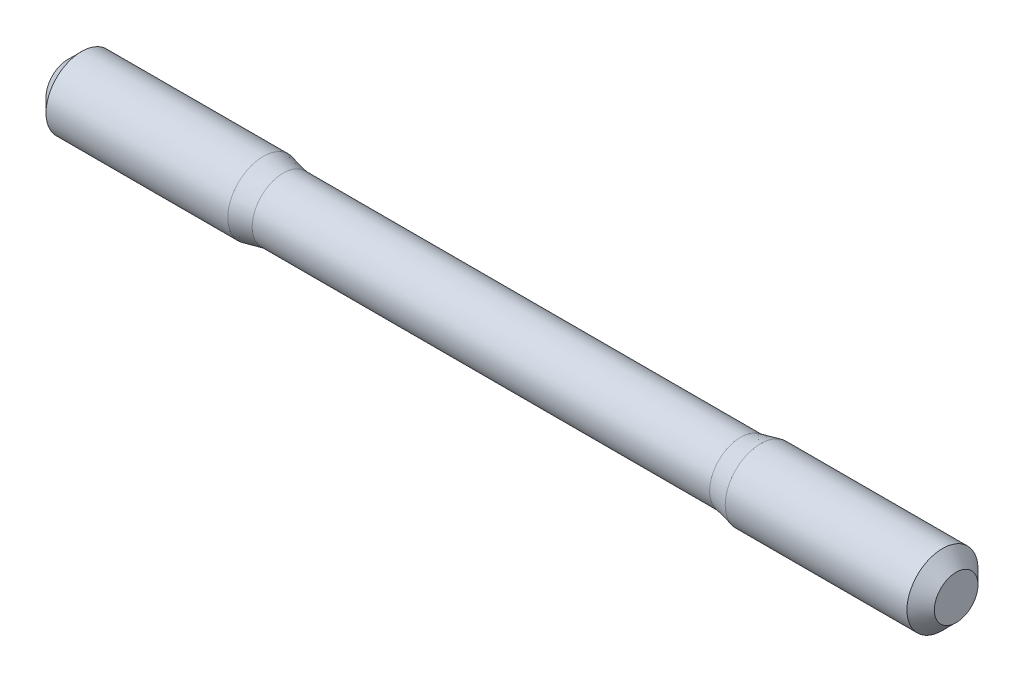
SolidWorks part; units mm, degrees
ref_plane "Front" through (0, 0, 0) normal (0, 0, 1) x (1, 0, 0)
ref_plane "Top" through (0, 0, 0) normal (0, 1, 0) x (1, 0, 0)
ref_plane "Right" through (0, 0, 0) normal (1, 0, 0) x (0, 0, -1)
sketch "Sketch1" plane through (0, 0, 0) normal (0, 0, 1) x (1, 0, 0)
  line L0 (-1.3108, 0) -> (30.3862, 0) construction
  line L1 (0, 0) -> (0, 4)
  line L2 (0, 4) -> (22, 4)
  line L3 (22, 4) -> (24.25, 3.5)
  line L4 (24.25, 3.5) -> (75.75, 3.5)
  line L5 (75.75, 3.5) -> (78, 4)
  line L6 (78, 4) -> (100, 4)
  line L7 (100, 4) -> (100, 0)
  line L8 (100, 0) -> (0, 0)
  dimension "D1" = 22
  dimension "X" = 2.25
  dimension "D2" = 2.25
  dimension "b" = 22
  dimension "l" = 100
  dimension "d" = 8
  dimension "ds" = 7
revolve "Base" add sketch "Sketch1" angle 360 about L0
chamfer "HeadChamfer" distance 1.5415 angle 45 2 edges at (0, 0, 4) (100, 0, 4)
sketch "Sketch2" plane through (0, 0, 0) normal (0, 0, 1) x (1, 0, 0)
  line L0 (98.4585, 2.665) -> (99.2292, 4)
  line L1 (99.2292, 4) -> (99.2292, 4.5)
  line L2 (99.2292, 4.5) -> (97.6877, 4.5)
  line L3 (97.6877, 4.5) -> (97.6877, 4)
  line L4 (97.6877, 4) -> (98.4585, 2.665)
  line L5 (0, 0) -> (114.8799, 0) construction
  line L6 (98.4585, 4) -> (98.4585, -4) construction
  dimension "D1" = 60
  dimension "D2" = 60
  dimension "D3" = 0.5
  dimension "D4" = 1.5415
  dimension "D5" = 8
revolve "Cut-Revolve10" [suppressed] cut sketch "Sketch2" angle 360 about L5
pattern_linear "LPattern10" [suppressed] count 12 spacing 1.8498 along (1, 0, 0)
sketch "Sketch3" plane through (0, 0, 0) normal (0, 0, 1) x (1, 0, 0)
  line L0 (1.5415, 2.665) -> (2.3123, 4)
  line L1 (2.3123, 4) -> (2.3123, 4.5)
  line L2 (2.3123, 4.5) -> (0.7708, 4.5)
  line L3 (0.7708, 4.5) -> (0.7708, 4)
  line L4 (0.7708, 4) -> (1.5415, 2.665)
  line L5 (0, 0) -> (15.3216, 0) construction
  line L6 (0, 2.4585) -> (0, -2.4585) construction
  line L7 (1.5415, 4) -> (1.5415, -4) construction
  dimension "D1" = 60
  dimension "D2" = 60
  dimension "D3" = 8
  dimension "D4" = 0.5
  dimension "D5" = 1.5415
revolve "Cut-Revolve11" [suppressed] cut sketch "Sketch3" angle 360 about L5
pattern_linear "LPattern11" [suppressed] count 4 spacing 1.8498 along (1, 0, 0)
equation "\"D2@Sketch1\" = \"X@Sketch1\""
equation "\"D2@ThreadCosmetic2\" = \"D2@ThreadCosmetic1\""
equation "\"b@ThreadCosmetic2\" = \"b@Sketch1\""
equation "\"D1@HeadChamfer\" =  ( \"d@Sketch1\" - \"D2@ThreadCosmetic1\" )  / 2"
equation "\"D1@Sketch1\" = \"b@Sketch1\""
equation "\"D5@Sketch2\" = \"d@Sketch1\""
equation "\"D4@Sketch2\" =  ( \"d@Sketch1\" - \"D2@ThreadCosmetic2\" )  / 2"
equation "\"D3@LPattern10\" = \"D4@Sketch2\" * 1.2"
equation "\"D1@LPattern10\" = \"b@ThreadCosmetic2\" / \"D3@LPattern10\""
equation "\"D3@Sketch3\" = \"d@Sketch1\""
equation "\"D5@Sketch3\"  =  ( \"d@Sketch1\" - \"D2@ThreadCosmetic1\" )  / 2"
equation "\"D3@LPattern11\" = \"D5@Sketch3\" * 1.2"
equation "\"D1@LPattern11\" = \"D1@ThreadCosmetic1\" / \"D3@LPattern11\""
